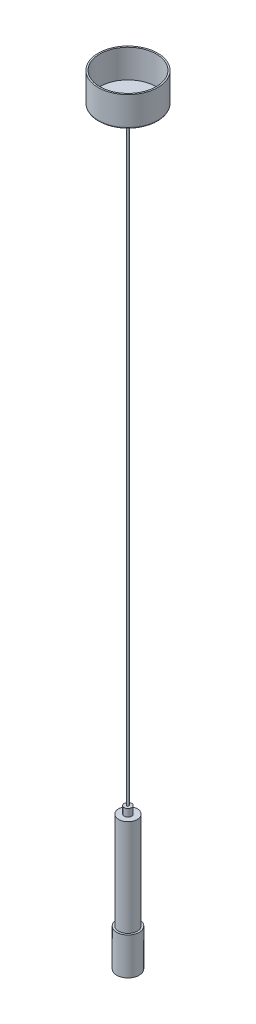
SolidWorks part; units mm, degrees
ref_plane "Alzado" through (0, 0, 0) normal (0, 0, 1) x (1, 0, 0)
ref_plane "Planta" through (0, 0, 0) normal (0, 1, 0) x (1, 0, 0)
ref_plane "Vista lateral" through (0, 0, 0) normal (1, 0, 0) x (0, 0, -1)
sketch "Croquis1" plane through (0, 0, 0) normal (0, 1, 0) x (1, 0, 0)
  circle A0 centre (0, 0) radius 12.5
  dimension "D1" = 25
extrude "Saliente-Extruir1" add sketch "Croquis1" along normal blind 130
sketch "Croquis2" plane through (0, 0, 0) normal (0, -1, 0) x (1, 0, 0)
  circle A0 centre (0, 0) radius 15
extrude "Saliente-Extruir2" add sketch "Croquis2" along normal blind 50 separate body
sketch "Croquis3" plane through (0, 130, 0) normal (0, 1, 0) x (1, 0, 0)
  circle A0 centre (0, 0) radius 5
  dimension "D1" = 10
extrude "Saliente-Extruir3" add sketch "Croquis3" along normal blind 10 separate body
sketch "Croquis4" plane through (0, 140, 0) normal (0, 1, 0) x (1, 0, 0)
  circle A0 centre (0, 0) radius 1.25
  dimension "D1" = 2.5
extrude "Saliente-Extruir4" add sketch "Croquis4" along normal blind 800 separate body
sketch "Croquis5" plane through (0, 940, 0) normal (0, 1, 0) x (1, 0, 0)
  circle A0 centre (0, 0) radius 5
  dimension "D1" = 10
extrude "Saliente-Extruir5" add sketch "Croquis5" along normal blind 15 separate body
sketch "Croquis6" plane through (0, 955, 0) normal (0, 1, 0) x (1, 0, 0)
  circle A0 centre (0, 0) radius 40
  dimension "D1" = 80
extrude "Saliente-Extruir6" add sketch "Croquis6" along normal blind 40 separate body
fillet "Redondeo1" radius 2 1 edges at (0, 955, 40)
shell "Vaciado1" thickness 2
sketch "Croquis7" plane through (0, -50, 0) normal (0, -1, 0) x (1, 0, 0)
  circle A0 centre (0, 0) radius 11
  dimension "D1" = 22
extrude "Cortar-Extruir1" cut sketch "Croquis7" against normal blind 3
sketch "Croquis8" plane through (0, -47, 0) normal (0, -1, 0) x (1, 0, 0)
  circle A1 centre (0, 0) radius 11
  circle A2 centre (0, 0) radius 11
  dimension "D1" = 0
extrude "Saliente-Extruir7" add sketch "Croquis8" along normal blind 3 separate body
